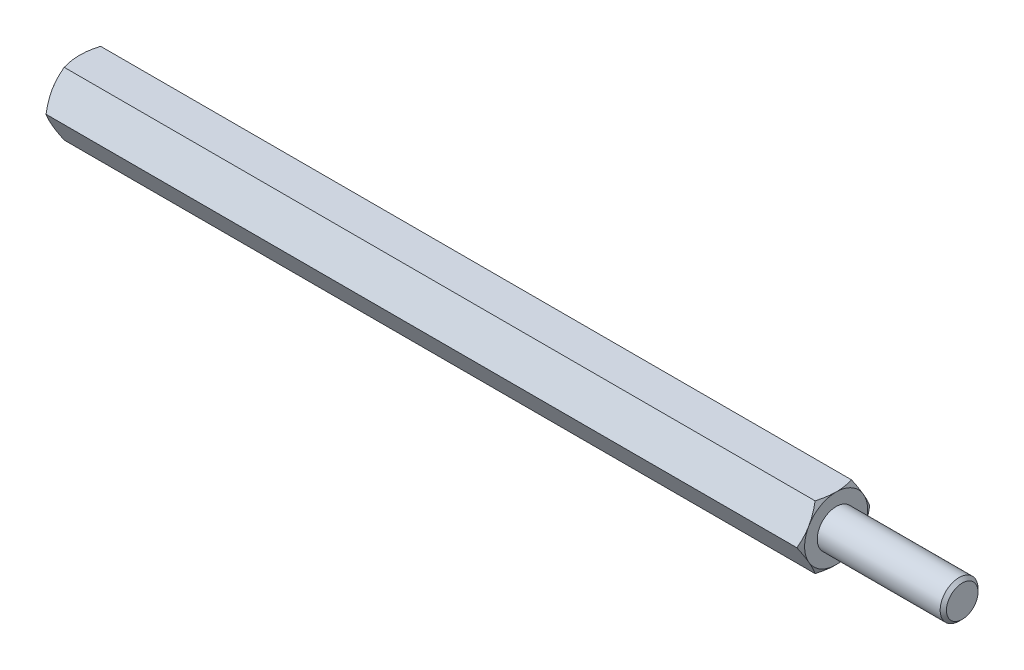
SolidWorks part; units mm, degrees
ref_plane "Front Plane" through (0, 0, 0) normal (0, 0, 1) x (1, 0, 0)
ref_plane "Top Plane" through (0, 0, 0) normal (0, 1, 0) x (1, 0, 0)
ref_plane "Right Plane" through (0, 0, 0) normal (1, 0, 0) x (0, 0, -1)
sketch "Sketch1" plane through (0, 0, 0) normal (1, 0, 0) x (0, 0, -1)
  line L1 (1.4434, 2.5) -> (-1.4434, 2.5)
  line L2 (-1.4434, 2.5) -> (-2.8868, 0)
  line L3 (-2.8868, 0) -> (-1.4434, -2.5)
  line L4 (-1.4434, -2.5) -> (1.4434, -2.5)
  line L5 (1.4434, -2.5) -> (2.8868, 0)
  line L6 (2.8868, 0) -> (1.4434, 2.5)
  circle A0 centre (0, 0) radius 2.5 construction
  dimension "D1" = 5
extrude "Extrude2" add sketch "Sketch1" along normal mid plane 60
sketch "Sketch2" plane through (0, 0, 0) normal (0, 0, 1) x (1, 0, 0)
  line L0 (-30, 2.5) -> (-28.5, 5.0981)
  line L1 (-30, 5.5) -> (-30, 2.5)
  line L3 (0, 0) -> (50000, 0) construction
  arc A0 (-28.5, 5.0981) -> (-30, 5.5) centre (-29.1962, 5.5) ccw
  dimension "D1" = 30
  dimension "D2" = 3
revolve "Cut-Revolve1" cut sketch "Sketch2" angle 360 about L3
mirror "Mirror1" about plane through (0, 0, 0) normal (1, 0, 0) of "Cut-Revolve1"
sketch "Sketch3" plane through (-30, 0, 0) normal (-1, 0, 0) x (0, 0, 1)
  circle A0 centre (0, 0) radius 1.25
  dimension "D1" = 2.5
extrude "Extrude3" cut sketch "Sketch3" against normal blind 10
sketch "Sketch4" plane through (0, 0, 0) normal (0, 0, 1) x (1, 0, 0)
  line L0 (-20, 0) -> (-20, 1.25)
  line L1 (29.7767, 0) -> (-29.7767, 0) construction
  line L2 (-20, 1.25) -> (-19.2783, 0)
  line L3 (-19.2783, 0) -> (-20, 0)
  line L4 (-30, 1.25) -> (-30, -1.25) construction
  point P4 (-30, 0)
  dimension "D1" = 30
  dimension "D2" = 1.25
  dimension "D3" = 10
revolve "Cut-Revolve2" cut sketch "Sketch4" angle 360 about L3
sketch "Sketch5" plane through (30, 0, 0) normal (1, 0, 0) x (0, 0, -1)
  circle A0 centre (0, 0) radius 1.5
  dimension "D1" = 3
extrude "Extrude4" add sketch "Sketch5" along normal blind 10
chamfer "Chamfer1" distance 0.25 angle 45 1 edges at (40, 0, -1.5)
equation "\"D2@Sketch4\" = \"D1@Sketch3\"/2"
